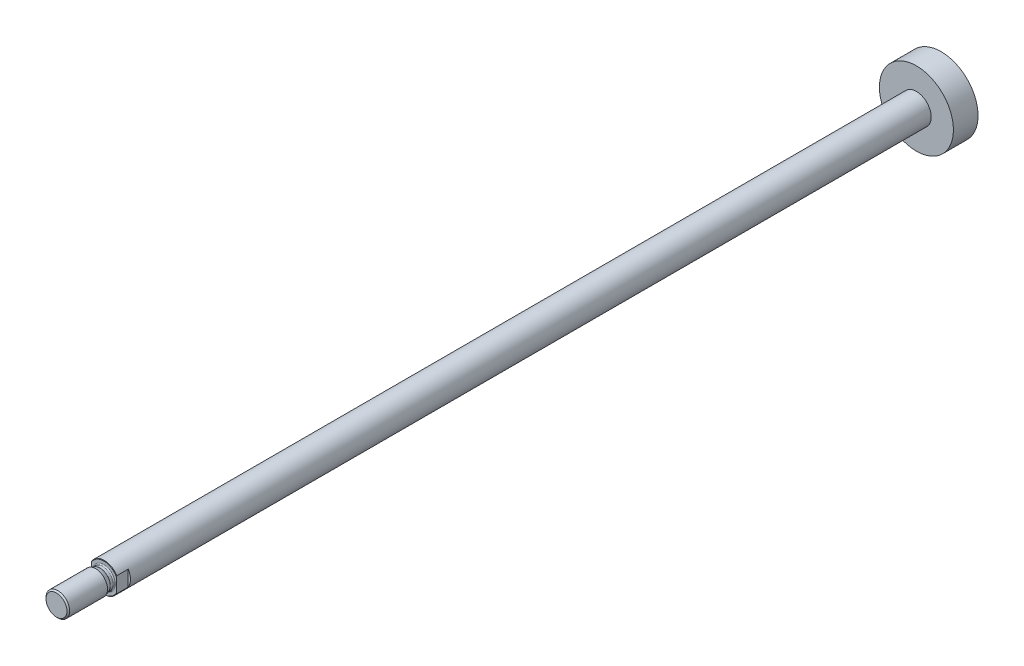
SolidWorks part; units mm, degrees
ref_plane "Plano frontal" through (0, 0, 0) normal (0, 0, 1) x (1, 0, 0)
ref_plane "Plano superior" through (0, 0, 0) normal (0, 1, 0) x (1, 0, 0)
ref_plane "Plano direito" through (0, 0, 0) normal (1, 0, 0) x (0, 0, -1)
imported_body "Bruto-CPME50-300-A-1"
split "Dividir1" bodies to split 101 resulting bodies 102 103
move or copy body "Corpo-Mover/Copiar1" bodies to move or copy 102 copy no translate (0, 0, 157)
sketch "Esboço1" plane through (0, 0, -199.3333) normal (0, 0, -1) x (-1, 0, 0)
  circle A1 centre (0, 0) radius 10
  circle A2 centre (0, 0) radius 10
  dimension "D1" = 0
extrude "Ressalto-extrusão1" add sketch "Esboço1" along normal up to next
